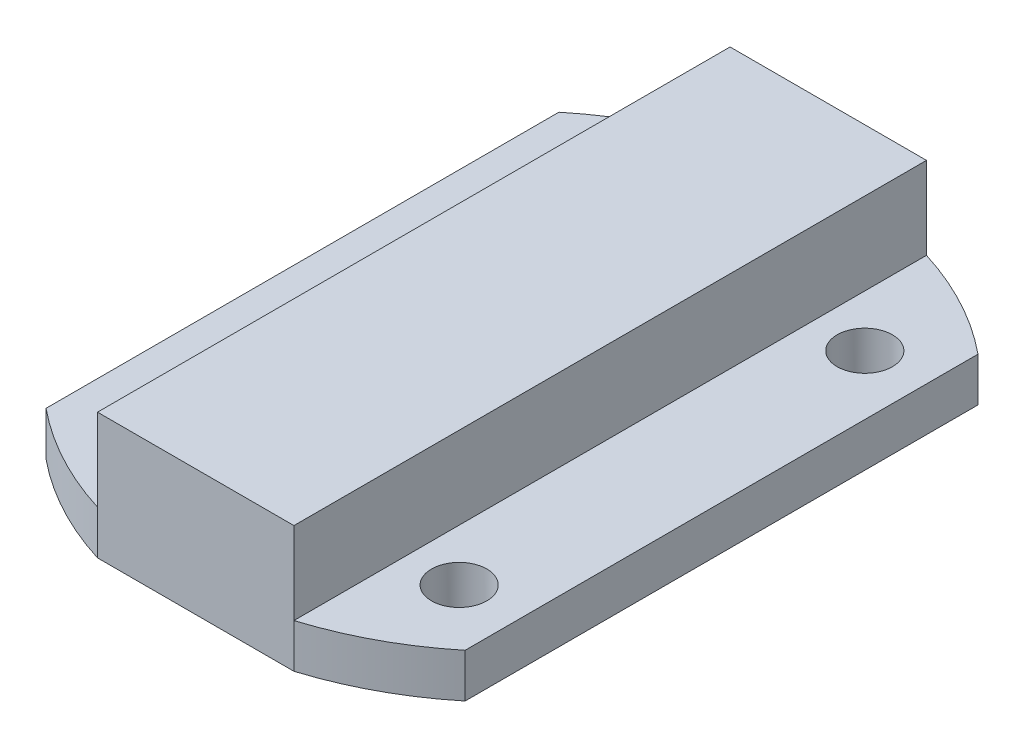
SolidWorks part; units mm, degrees
ref_plane "Front Plane" through (0, 0, 0) normal (0, 0, 1) x (1, 0, 0)
ref_plane "Top Plane" through (0, 0, 0) normal (0, 1, 0) x (1, 0, 0)
ref_plane "Right Plane" through (0, 0, 0) normal (1, 0, 0) x (0, 0, -1)
sketch "Sketch1" plane through (0, 0, 0) normal (0, 0, 1) x (1, 0, 0)
  line L0 (0, 0) -> (0, 35.0387) construction
  line L1 (7.5057, 0) -> (-7.5057, 0)
  line L2 (-7.5057, 0) -> (-7.5057, 1.5748)
  line L3 (-7.5057, 1.5748) -> (-3.5179, 1.5748)
  line L4 (-3.5179, 1.5748) -> (-3.5179, 4.5212)
  line L5 (-3.5179, 4.5212) -> (3.5179, 4.5212)
  line L6 (3.5179, 1.5748) -> (3.5179, 4.5212)
  line L7 (7.5057, 1.5748) -> (3.5179, 1.5748)
  line L8 (7.5057, 0) -> (7.5057, 1.5748)
  point P9 (0, 4.5212)
  dimension "D1" = 7.0358
  dimension "D2" = 15.0114
  dimension "D3" = 1.5748
  dimension "D4" = 4.5212
extrude "Boss-Extrude1" add sketch "Sketch1" along normal blind 22.6568
sketch "Sketch3" plane through (0, 4.5212, 0) normal (0, 1, 0) x (1, 0, 0)
  line L0 (0, -11.3284) -> (-3.5179, -11.3284) construction
  line L1 (-3.5179, -22.6568) -> (-3.5179, 0) construction
  line L2 (0, -11.3284) -> (0, 0) construction
  line L3 (3.5179, 0) -> (-3.5179, 0) construction
  line L4 (5.3721, -4.064) -> (5.3721, -18.5928) construction
  line L5 (5.3721, -11.3284) -> (0, -11.3284) construction
  line L6 (0, -11.3284) -> (-5.3721, -11.3284) construction
  line L7 (-5.3721, -11.3284) -> (-5.3721, -8.382) construction
  line L8 (5.3721, -19.5834) -> (10.3168, -19.5834) construction
  line L9 (10.3168, -19.5834) -> (10.3168, -3.0734) construction
  line L10 (10.3168, -3.0734) -> (5.3721, -3.0734) construction
  circle A0 centre (0, -11.3284) radius 11.8621
  circle A1 centre (5.3721, -18.5928) radius 0.9906
  circle A2 centre (5.3721, -4.064) radius 0.9906
  circle A3 centre (-5.3721, -8.382) radius 0.9906
  dimension "D2" = 1.9812
  dimension "D4" = 8.382
  dimension "D1" = 8.89
  dimension "D3" = 16.51
extrude "Cut-Extrude1" cut sketch "Sketch3" against normal through all flip side to cut
